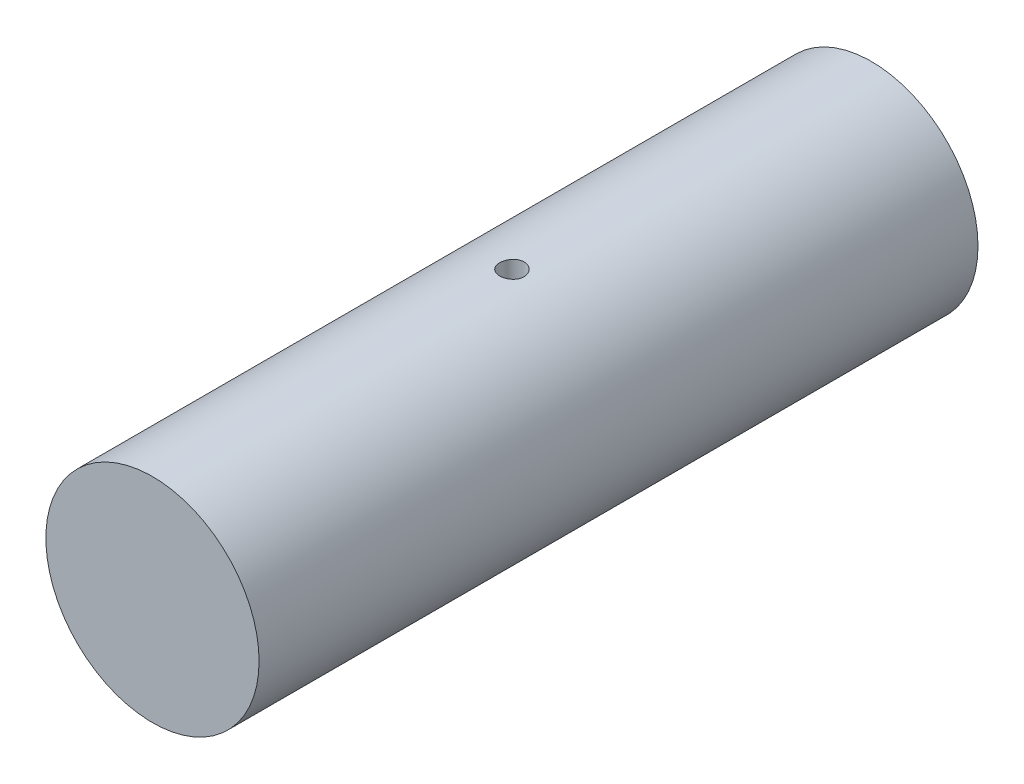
SolidWorks part; units mm, degrees
ref_plane "Plan de face" through (0, 0, 0) normal (0, 0, 1) x (1, 0, 0)
ref_plane "Plan de dessus" through (0, 0, 0) normal (0, 1, 0) x (1, 0, 0)
ref_plane "Plan de droite" through (0, 0, 0) normal (1, 0, 0) x (0, 0, -1)
sketch "Esquisse1" plane through (0, 0, 0) normal (0, 0, 1) x (1, 0, 0)
  circle A0 centre (0, 0) radius 17.5
  dimension "D1" = 35
extrude "Boss.-Extru.1" add sketch "Esquisse1" along normal blind 118
sketch "Esquisse2" plane through (0, 0, 0) normal (0, 1, 0) x (1, 0, 0)
  line L0 (0, -118) -> (0, 0) construction
  line L1 (-17.5, -118) -> (17.5, -118) construction
  circle A0 centre (0, -59) radius 2
  dimension "D1" = 4
  dimension "D2" = 59
extrude "Enlèv. mat.-Extru.1" cut sketch "Esquisse2" against normal through all and the other way through all
